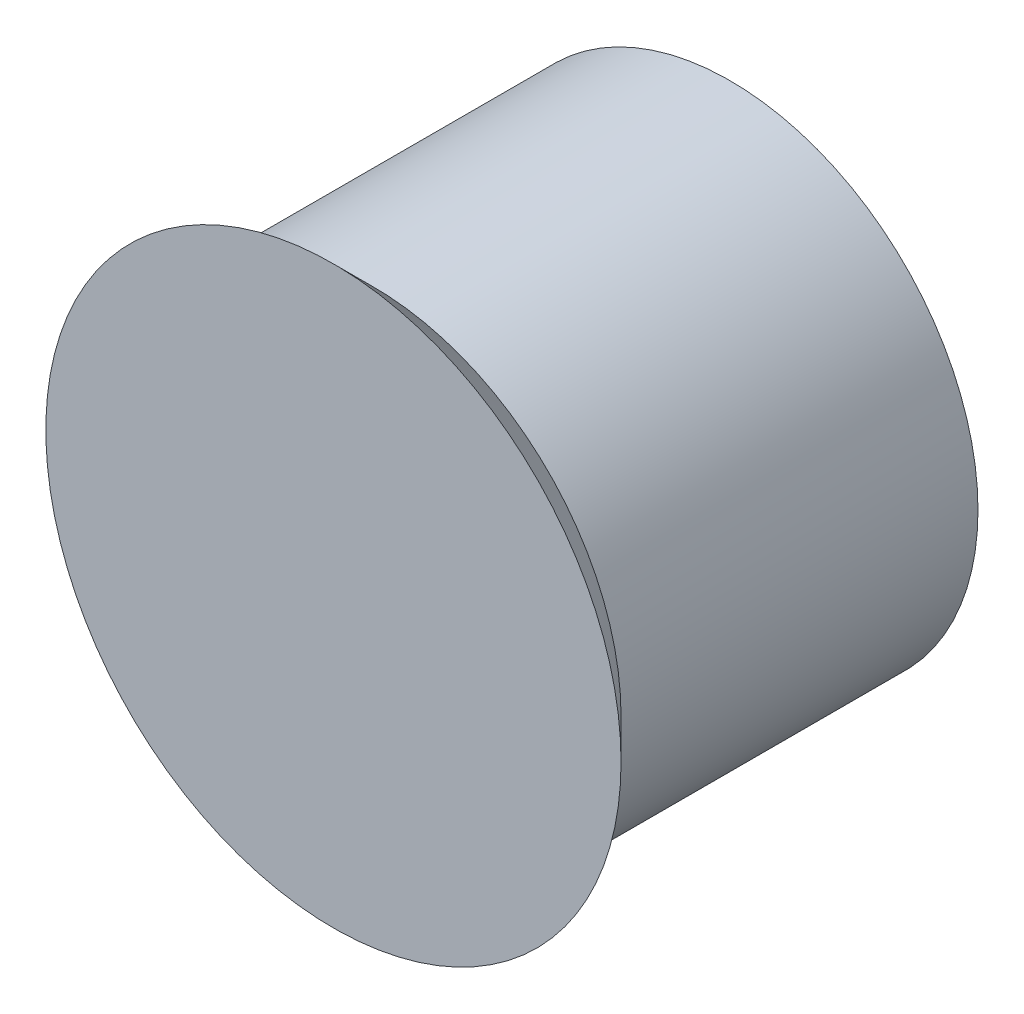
SolidWorks part; units mm, degrees
ref_plane "Ön Düzlem" through (0, 0, 0) normal (0, 0, 1) x (1, 0, 0)
ref_plane "Üst Düzlem" through (0, 0, 0) normal (0, 1, 0) x (1, 0, 0)
ref_plane "Sağ Düzlem" through (0, 0, 0) normal (1, 0, 0) x (0, 0, -1)
sketch "Çizim1" plane through (0, 0, 0) normal (0, 0, 1) x (1, 0, 0)
  circle A0 centre (0, 0) radius 1.25
  dimension "D1" = 2.5
extrude "Yükseklik-Ekstrüzyon1" add sketch "Çizim1" along normal blind 1.8
sketch "Çizim2" plane through (0, 0, 1.8) normal (0, 0, 1) x (1, 0, 0)
  circle A0 centre (0, 0) radius 1.2502
extrude "Yükseklik-Ekstrüzyon2" add sketch "Çizim2" along normal blind 0.2 draft 45
